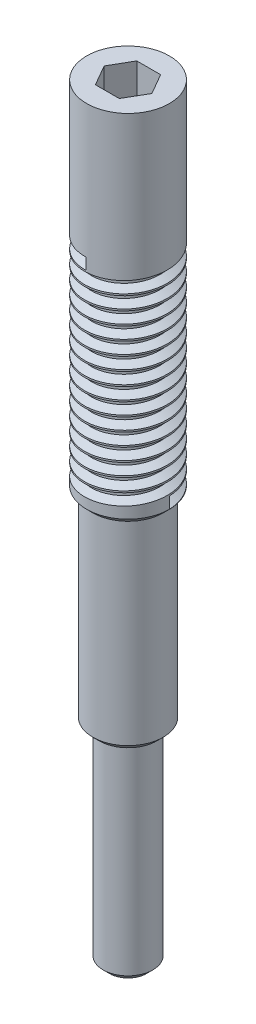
SolidWorks part; units mm, degrees
ref_plane "前视基准面" through (0, 0, 0) normal (0, 0, 1) x (1, 0, 0)
ref_plane "上视基准面" through (0, 0, 0) normal (0, 1, 0) x (1, 0, 0)
ref_plane "右视基准面" through (0, 0, 0) normal (1, 0, 0) x (0, 0, -1)
other "Configuration Table"
sketch "草图1" plane through (0, 0, 0) normal (0, 0, 1) x (1, 0, 0)
  line L0 (0, 0) -> (-1.2, 0)
  line L1 (-1.2, 0) -> (-1.2, 10)
  line L2 (-1.2, 10) -> (-1.7, 10)
  line L3 (-1.7, 10) -> (-1.7, 20)
  line L4 (-1.7, 20) -> (-2, 20)
  line L5 (-2, 20) -> (-2, 37)
  line L6 (-2, 37) -> (0, 37)
  line L7 (0, 0) -> (0, 7.7962) construction
  line L8 (0, 0) -> (0, 37)
  point P3 (-1.7, 5.61)
  point P11 (-2, 13.0305)
  dimension "D1" = 1.2
  dimension "D2" = 1.7
  dimension "D3" = 2
  dimension "D4" = 10
  dimension "D5" = 10
  dimension "D6" = 17
revolve "旋转1" add sketch "草图1" angle 360 about L7
thread "螺纹线1" pitch 0.635 start angle 0, offset 0, length 10, pitch 0.635, diameter 4
ref_plane "基准面1" through (2, 20, 0) normal (0, 0, 1) x (1, 0, 0)
sketch "螺纹线轮廓1" plane through (2, 20, 0) normal (0, 0, 1) x (1, 0, 0)
  line L0 (0, 0) -> (0, 0.635) construction
  line L11 (0, 0) -> (0, 0.5556)
  line L12 (0, 0.5556) -> (-0.3437, 0.3572)
  line L13 (-0.3437, 0.3572) -> (-0.3437, 0.1984)
  line L15 (-0.3437, 0.1984) -> (0, 0)
  line L17 (-0.3437, 0.2778) -> (0, 0.2778) construction
  point P2 (0, 0)
  dimension "Pitch" = 0.635
  dimension "Profile_Angle" = 60
  dimension "Profile_Land" = 0.1588
  dimension "Profile_Height" = 0.3437
chamfer "倒角1" distance 0.3 angle 45 3 edges at (0, 20, -1.7) (0, 10, -1.7) (0, 0, -1.2)
sketch "草图5" plane through (0, 37, 0) normal (0, 1, 0) x (1, 0, 0)
  line L1 (0.5774, 1) -> (-0.5774, 1)
  line L2 (-0.5774, 1) -> (-1.1547, 0)
  line L3 (-1.1547, 0) -> (-0.5774, -1)
  line L4 (-0.5774, -1) -> (0.5774, -1)
  line L5 (0.5774, -1) -> (1.1547, 0)
  line L6 (1.1547, 0) -> (0.5774, 1)
  circle A0 centre (0, 0) radius 1 construction
  dimension "D1" = 2
extrude "切除-拉伸1" cut sketch "草图5" against normal blind 4
